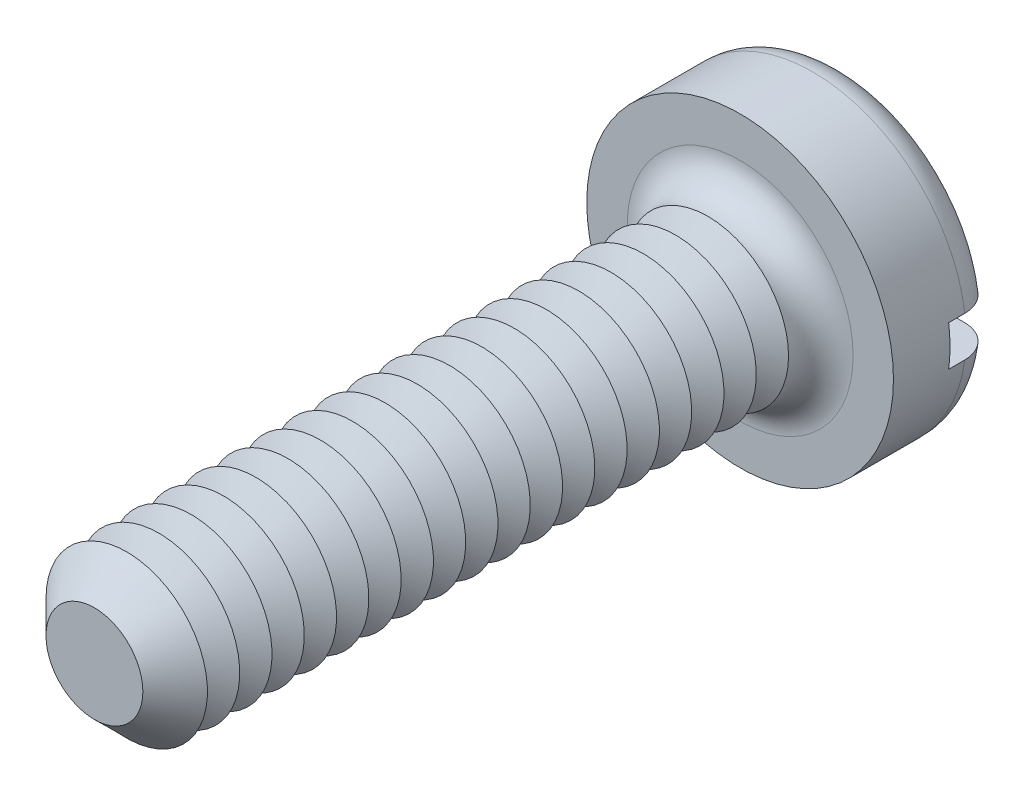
SolidWorks part; units mm, degrees
ref_plane "Front Plane" through (0, 0, 0) normal (0, 0, 1) x (1, 0, 0)
ref_plane "Top Plane" through (0, 0, 0) normal (0, 1, 0) x (1, 0, 0)
ref_plane "Right Plane" through (0, 0, 0) normal (1, 0, 0) x (0, 0, -1)
sketch "Sketch3" plane through (0, 0, 0) normal (0, 0, 1) x (1, 0, 0)
  circle A0 centre (0, 0) radius 1.9
  dimension "D1" = 3.8
extrude "Boss-Extrude2" add sketch "Sketch3" against normal blind 1.3
sketch "Sketch4" plane through (0, 0, 0) normal (0, 0, 1) x (1, 0, 0)
  circle A0 centre (0, 0) radius 1
  dimension "D1" = 2
extrude "Boss-Extrude3" add sketch "Sketch4" along normal blind 8
fillet "Fillet1" radius 0.4 2 edges at (1.9, 0, -1.3) (1, 0, 0)
chamfer "Chamfer1" distance 0.4 angle 45 1 edges at (1, 0, 8)
sketch "Sketch5" plane through (0, 0, 0) normal (1, 0, 0) x (0, 0, -1)
  line L0 (1.6944, 0) -> (-7.6738, 0) construction
sketch "Sketch6" plane through (0, 0, 0) normal (1, 0, 0) x (0, 0, -1)
  line L0 (-0.4, 1) -> (-0.6, 0.6536)
  line L1 (-0.6, 0.6536) -> (-0.8, 1)
  line L2 (-0.4, 1) -> (-7.6, 1) construction
  line L3 (-0.8, 1) -> (-0.4, 1)
  dimension "D1" = 0.4
revolve "Cut-Revolve1" cut sketch "Sketch6" angle 360 about L0
pattern_linear "LPattern1" count 18 spacing 0.4 along (0, 0, 1) of "Cut-Revolve1"
sketch "Sketch8" plane through (0, 0, -1.3) normal (0, 0, -1) x (-1, 0, 0)
  line L1 (1.9, -0.25) -> (-1.9, -0.25)
  line L2 (1.9, -0.25) -> (1.9, 0.25)
  line L3 (1.9, 0.25) -> (-1.9, 0.25)
  line L4 (-1.9, -0.25) -> (-1.9, 0.25)
  line L5 (1.9, -0.25) -> (-1.9, 0.25) construction
  line L6 (1.9, 0.25) -> (-1.9, -0.25) construction
  point P0 (0, 0)
  dimension "D1" = 3.8
  dimension "D2" = 0.5
extrude "Cut-Extrude1" cut sketch "Sketch8" against normal blind 0.6
